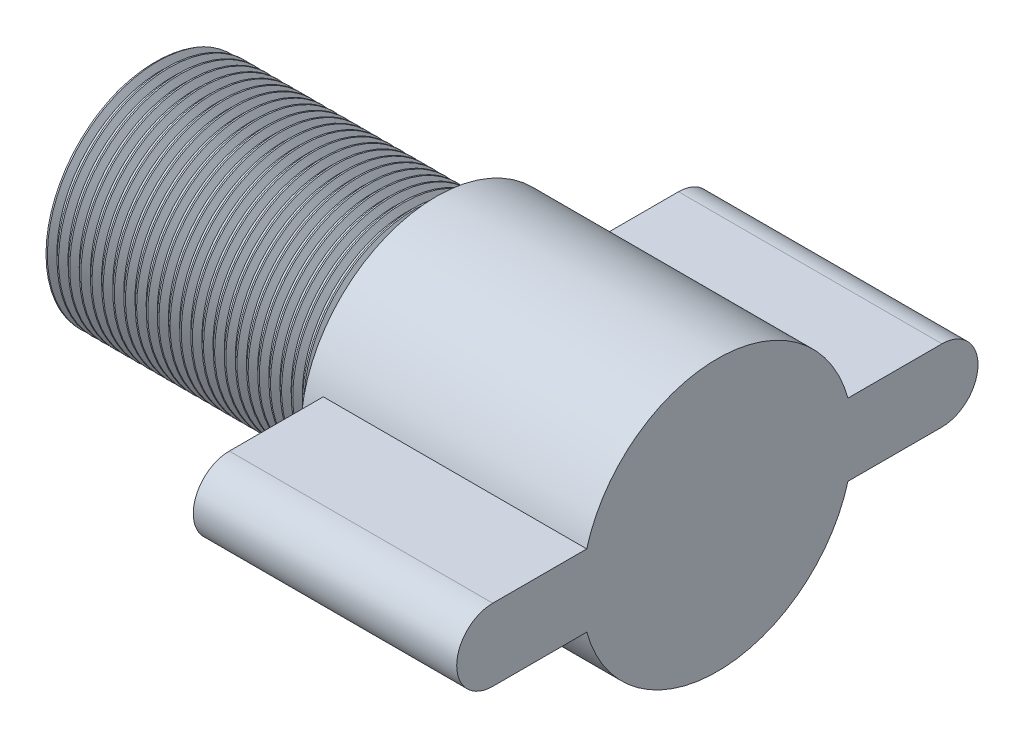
SolidWorks part; units mm, degrees
ref_plane "Front" through (0, 0, 0) normal (0, 0, 1) x (1, 0, 0)
ref_plane "Top" through (0, 0, 0) normal (0, 1, 0) x (1, 0, 0)
ref_plane "Right" through (0, 0, 0) normal (1, 0, 0) x (0, 0, -1)
sketch "Sketch1" plane through (0, 0, 0) normal (1, 0, 0) x (0, 0, -1)
  circle A0 centre (0, 0) radius 3.175
  dimension "D1" = 6.35
extrude "Boss-Extrude1" add sketch "Sketch1" along normal blind 8
sketch "Sketch2" plane through (8, 0, 0) normal (1, 0, 0) x (0, 0, -1)
  circle A0 centre (0, 0) radius 3.8575
extrude "Boss-Extrude2" add sketch "Sketch2" along normal blind 8 contours A0
thread "Thread1" pitch 0.3175 start angle 0, offset 0, length 10, pitch 0.3175, diameter 6.35
ref_plane "Plane1" through (8, 0, 3.175) normal (0, -1, 0) x (0, 0, 1)
sketch "Thread Profile1" plane through (8, 0, 3.175) normal (0, -1, 0) x (0, 0, 1)
  line L0 (0, 0) -> (0, 0.3175) construction
  line L11 (0, 0) -> (0, 0.2778)
  line L12 (0, 0.2778) -> (-0.1719, 0.1786)
  line L13 (-0.1719, 0.1786) -> (-0.1719, 0.0992)
  line L15 (-0.1719, 0.0992) -> (0, 0)
  line L17 (-0.1719, 0.1389) -> (0, 0.1389) construction
  point P2 (0, 0)
  dimension "Pitch" = 0.3175
  dimension "Profile_Angle" = 60
  dimension "Profile_Land" = 0.0794
  dimension "Profile_Height" = 0.1719
sketch "Sketch5" plane through (16, 0, 0) normal (1, 0, 0) x (0, 0, -1)
  line L0 (0, 3.8575) -> (0, -3.8575) construction
  line L1 (3.6908, -1.0261) -> (6.3945, -1.0261)
  line L2 (-3.6908, 1.0261) -> (-6.3945, 1.0261)
  line L3 (-3.6908, 1.0261) -> (-3.6908, -1.0261)
  line L4 (-3.6908, -1.0261) -> (-6.3945, -1.0261)
  line L6 (3.6908, 1.0261) -> (3.6908, -1.0261)
  line L7 (3.6908, 1.0261) -> (6.3945, 1.0261)
  arc A1 (-6.3945, 1.0261) -> (-6.3945, -1.0261) centre (-6.3945, 0) ccw
  circle A2 centre (0, 0) radius 3.8575 construction
  arc A3 (6.3945, 1.0261) -> (6.3945, -1.0261) centre (6.3945, 0) cw
  point P9 (0, 0)
  point P12 (-3.6908, 0)
  point P20 (3.6908, 0)
extrude "Boss-Extrude3" add sketch "Sketch5" against normal blind 7.5
sketch "Sketch6" plane through (8, 0, 0) normal (-1, 0, 0) x (0, 0, 1)
  circle A0 centre (0, 0) radius 3.8575
